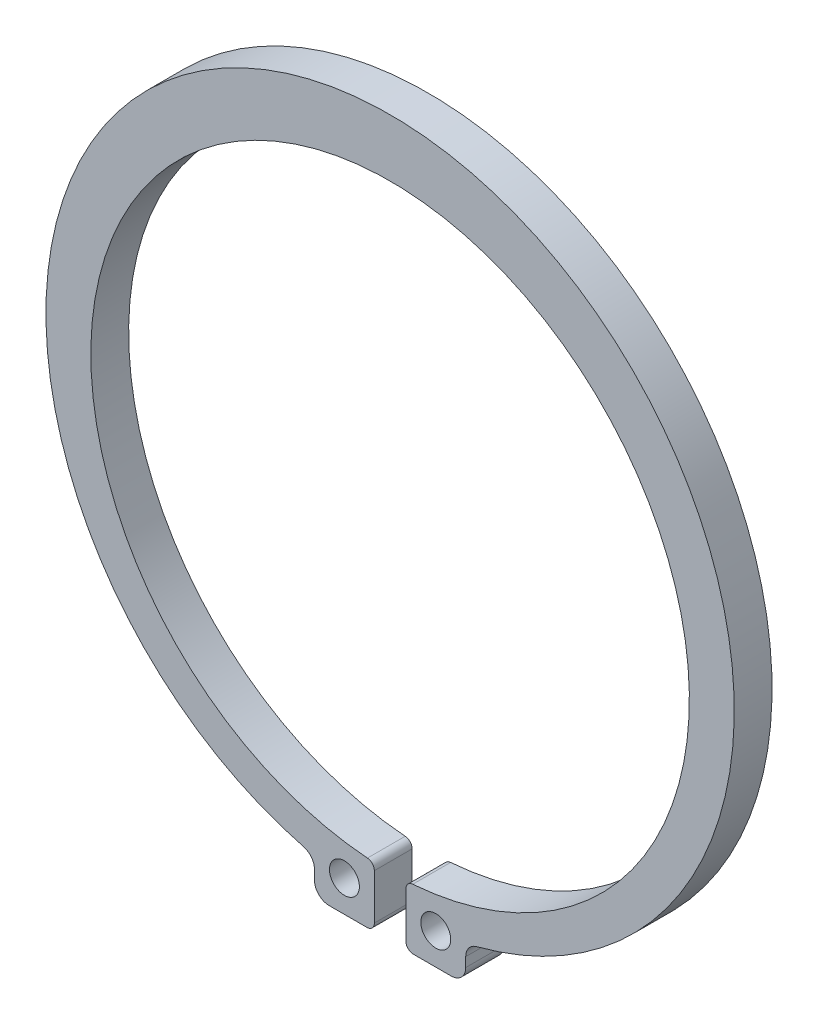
SolidWorks part; units mm, degrees
ref_plane "Plane1" through (0, 0, 0) normal (0, 0, 1) x (1, 0, 0)
ref_plane "Plane2" through (0, 0, 0) normal (0, 1, 0) x (1, 0, 0)
ref_plane "Plane3" through (0, 0, 0) normal (1, 0, 0) x (0, 0, -1)
sketch "Esquisse1" plane through (0, 0, 0) normal (0, 0, 1) x (1, 0, 0)
  circle A0 centre (0, 0) radius 10.925
  dimension "D1" = 21.85
extrude "épaisseur" add sketch "Esquisse1" along normal blind 1.2
sketch "Esquisse2" plane through (0, 0, 1.2) normal (0, 0, 1) x (1, 0, 0)
  circle A0 centre (0, -0.4) radius 9.5
  dimension "D2" = 19
  dimension "D1" = 0.4
extrude "diam int" cut sketch "Esquisse2" against normal through all
sketch "Esquisse3" plane through (0, 0, 1.2) normal (0, 0, 1) x (1, 0, 0)
  line L0 (0, 0) -> (0, -55.7798) construction
  line L1 (-0.5, -9.8868) -> (-0.5, -10.9136)
  line L2 (0.5, -9.8868) -> (0.5, -10.9136)
  circle A0 centre (0, 0) radius 10.925 construction
  circle A1 centre (0, -0.4) radius 9.5 construction
  arc A2 (-0.5, -10.9136) -> (0.5, -10.9136) centre (0, 0) ccw
  arc A3 (-0.5, -9.8868) -> (0.5, -9.8868) centre (0, -0.4) ccw
  dimension "D1" = 1
extrude "fente" cut sketch "Esquisse3" against normal through all
sketch "Esquisse4" plane through (0, 0, 1.2) normal (0, 0, 1) x (1, 0, 0)
  line L0 (0, 0) -> (0, -64.5466) construction
  line L1 (0.5, -9.8868) -> (0.5, -11.7868)
  line L2 (0.5, -11.7868) -> (2.4, -11.7868)
  line L3 (2.4, -11.7868) -> (2.4, -9.5918)
  line L4 (-2.4, -11.7868) -> (-2.4, -9.5918)
  line L5 (-0.5, -11.7868) -> (-2.4, -11.7868)
  line L6 (-0.5, -9.8868) -> (-0.5, -11.7868)
  arc A0 (0.5, -9.8868) -> (-0.5, -9.8868) centre (0, -0.4) ccw construction
  arc A1 (0.5, -10.9136) -> (-0.5, -10.9136) centre (0, 0) ccw construction
  arc A2 (0.5, -9.8868) -> (2.4, -9.5918) centre (0, -0.4) ccw
  arc A3 (-0.5, -9.8868) -> (-2.4, -9.5918) centre (0, -0.4) cw
  dimension "D1" = 1.9
  dimension "D2" = 1.9
extrude "Boss" add sketch "Esquisse4" against normal blind 1.2
sketch "Esquisse5" plane through (0, 0, 1.2) normal (0, 0, 1) x (1, 0, 0)
  line L0 (-1.45, -11.7868) -> (-1.45, -9.7887) construction
  line L1 (-0.5, -11.7868) -> (-2.4, -11.7868) construction
  line L2 (-0.5, -46.2975) -> (-2.4, -46.2975) construction
  line L3 (-0.5, -9.8868) -> (-0.5, -11.7868) construction
  line L4 (-2.4, -11.7868) -> (-2.4, -10.6581) construction
  line L5 (0, -0.4) -> (0, -57.5369) construction
  circle A0 centre (-1.45, -10.7878) radius 0.475
  arc A3 (0.5, -9.8868) -> (-0.5, -9.8868) centre (0, -0.4) ccw construction
  circle A5 centre (1.45, -10.7878) radius 0.475
  dimension "D1" = 0.95
extrude "Enlèv. mat.-Extru.1" cut sketch "Esquisse5" against normal through all
fillet "Congé4" radius 0.4634 4 edges at (-2.4, -10.6581, 0.6) (-2.4, -11.7868, 0.6) (2.4, -10.6581, 0.6) (2.4, -11.7868, 0.6)
fillet "Congé5" radius 0.2375 4 edges at (-0.5, -9.8868, 0.6) (0.5, -9.8868, 0.6) (-0.5, -11.7868, 0.6) (0.5, -11.7868, 0.6)
equation "\"D1@Esquisse3\"=\"D1@Esquisse2\""
equation "\"D1@Esquisse2\"=\"D1@épaisseur\"/3"
equation "\"D1@Esquisse1\"=\"D2@Esquisse2\"*1.15"
equation "\"D1@Boss\"=\"D1@épaisseur\""
equation "\"D1@Esquisse4\"=\"D2@Esquisse2\"/10"
equation "\"D2@Esquisse4\"=\"D1@Esquisse4\""
equation "\"D1@Esquisse5\"=\"D2@Esquisse2\"/20"
equation "\"D1@Congé4\"=\"D2@Esquisse2\"/41"
equation "\"D1@Congé5\"=\"D2@Esquisse2\"/80"
